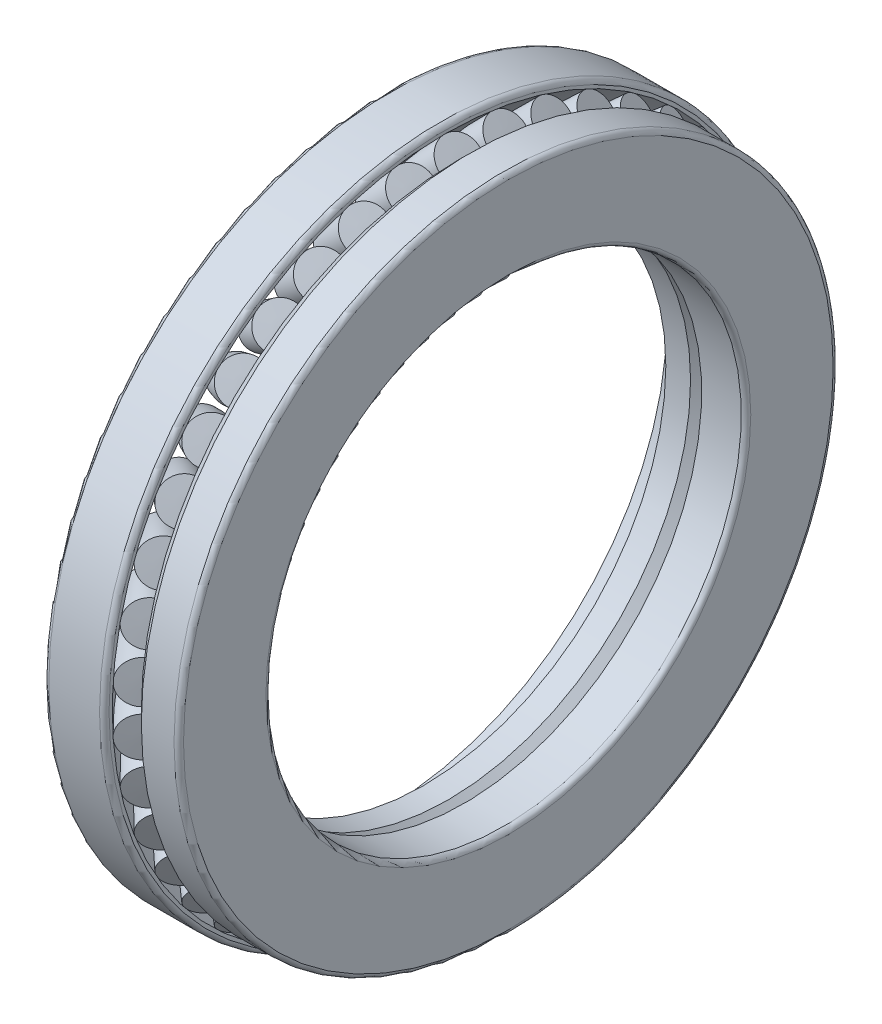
SolidWorks part; units mm, degrees
ref_plane "Front" through (0, 0, 0) normal (0, 0, 1) x (1, 0, 0)
ref_plane "Top" through (0, 0, 0) normal (0, 1, 0) x (1, 0, 0)
ref_plane "Right" through (0, 0, 0) normal (1, 0, 0) x (0, 0, -1)
other "Configuration Table"
sketch "Sketch1" plane through (0, 0, 0) normal (0, 0, 1) x (1, 0, 0)
  line L0 (-62.4031, 0) -> (236.3817, 0) construction
  line L1 (-20, 89) -> (-20, 106)
  line L2 (-18.5, 107.5) -> (-2.5, 107.5)
  line L3 (-1, 106) -> (-1, 105)
  line L4 (-15.2239, 89) -> (-20, 89)
  line L5 (101, 109.7192) -> (101, -154.5754) construction
  line L6 (19, 76.5) -> (19, 102.5)
  line L7 (17.5, 104) -> (7.1924, 104)
  line L8 (-1, 105) -> (8.1924, 95.8076)
  line L9 (-13.2239, 91.5527) -> (-5.2549, 83.5837)
  line L10 (-7.8076, 81.5837) -> (-7.8076, 76.5)
  line L11 (5, 75) -> (17.5, 75)
  line L12 (3.5962, 100.4038) -> (-9.2394, 87.5682) construction
  line L13 (7.1924, 104) -> (3.5962, 100.4038)
  line L14 (-7.8076, 76.5) -> (0, 76.5)
  line L15 (0, 76.5) -> (2.5, 79.0418)
  line L16 (2.5, 79.0418) -> (5, 75)
  arc A0 (-15.2239, 89) -> (-1, 105) centre (101, 0) cw
  arc A1 (-7.8076, 81.5837) -> (8.1924, 95.8076) centre (-96.8076, 197.8076) ccw
  arc A2 (-18.5, 107.5) -> (-20, 106) centre (-18.5, 106) ccw
  arc A3 (-1, 106) -> (-2.5, 107.5) centre (-2.5, 106) ccw
  arc A4 (19, 102.5) -> (17.5, 104) centre (17.5, 102.5) ccw
  arc A5 (17.5, 75) -> (19, 76.5) centre (17.5, 76.5) ccw
  point P24 (3.5962, 100.4038)
  point P27 (-7.8076, 79.0418)
  point P34 (-1, 107.5)
  point P39 (19, 75)
revolve "Revolve1" add sketch "Sketch1" angle 360 about L0
sketch "Sketch2" plane through (0, 0, 0) normal (0, 0, 1) x (1, 0, 0)
  line L0 (3.5962, 100.4038) -> (-9.2394, 87.5682) construction
  line L1 (-13.2239, 91.5527) -> (-5.2549, 83.5837) construction
  line L2 (-9.2394, 87.5682) -> (10.0306, 106.8383) construction
  line L3 (3.5962, 100.4038) -> (-9.2394, 87.5682)
  line L4 (-13.2239, 91.5527) -> (-9.2394, 87.5682)
  line L5 (-1.0671, 104.9348) -> (3.5962, 100.4038)
  arc A1 (-1.0671, 104.9348) -> (-13.2239, 91.5527) centre (101, 0) ccw
  arc A2 (-1, 105) -> (-15.2239, 89) centre (101, 0) ccw construction
revolve "Revolve2" add sketch "Sketch2" angle 360 about L2
pattern_circular "Circular-Pattern1" count 42 over 360 about axis through (0, 0, 0) along (1, 0, 0)
sketch "Sketch3" plane through (0, 0, 0) normal (0, 0, 1) x (1, 0, 0)
  line L0 (-7.8076, 81.5837) -> (-7.8076, 76.5) construction
  line L1 (-7.8076, 76.5) -> (0, 76.5) construction
  line L2 (2.5, 79.0418) -> (5, 75) construction
  line L3 (0, 76.5) -> (2.5, 79.0418) construction
  line L4 (5, 75) -> (17.5, 75) construction
  line L5 (19, 76.5) -> (19, 102.5) construction
  line L6 (-1, 105) -> (8.1924, 95.8076) construction
  line L7 (7.1924, 104) -> (3.5962, 100.4038) construction
  line L8 (17.5, 104) -> (7.1924, 104) construction
  line L9 (-7.8076, 81.5837) -> (-7.8076, 76.5)
  line L10 (-7.8076, 76.5) -> (0, 76.5)
  line L11 (2.5, 79.0418) -> (5, 75)
  line L12 (0, 76.5) -> (2.5, 79.0418)
  line L13 (5, 75) -> (17.5, 75)
  line L14 (19, 76.5) -> (19, 102.5)
  line L15 (3.5962, 100.4038) -> (8.1924, 95.8076)
  line L16 (7.1924, 104) -> (3.5962, 100.4038)
  line L17 (17.5, 104) -> (7.1924, 104)
  arc A0 (-7.8076, 81.5837) -> (8.1924, 95.8076) centre (-96.8076, 197.8076) ccw construction
  arc A1 (17.5, 75) -> (19, 76.5) centre (17.5, 76.5) ccw construction
  arc A2 (19, 102.5) -> (17.5, 104) centre (17.5, 102.5) ccw construction
  arc A3 (-7.8076, 81.5837) -> (8.1924, 95.8076) centre (-96.8076, 197.8076) ccw
  arc A4 (17.5, 75) -> (19, 76.5) centre (17.5, 76.5) ccw
  arc A5 (19, 102.5) -> (17.5, 104) centre (17.5, 102.5) ccw
revolve "Revolve3" add sketch "Sketch3" angle 360 about L0
equation "\"SR+1@Sketch1\" = \"xr@Sketch1\" + 1"
equation "\"1/3dt@Sketch1\" = \"dt@Sketch1\" / 3"
equation "\"D2@Sketch1\" =  \"db@Sketch1\" / 2 - 2"
equation "\"D3@Sketch1\" = \"D2@Sketch1\" / 2"
equation "\"xd+3@Sketch1\" = \"xd@Sketch1\"  +  3"
equation "\"D1@Circular-Pattern1\" = int( 3.14159265 / atn(( \"1/3dt@Sketch1\"/ 2) / sqr( \"xd1@Sketch1\" * \"xd1@Sketch1\"/4 - ( \"1/3dt@Sketch1\"/ 2) *  ( \"1/3dt@Sketch1\"/ 2))))"
equation "\"1/2gj@Sketch2\" = \"1/3dt@Sketch1\" / 2 + 0.002"
